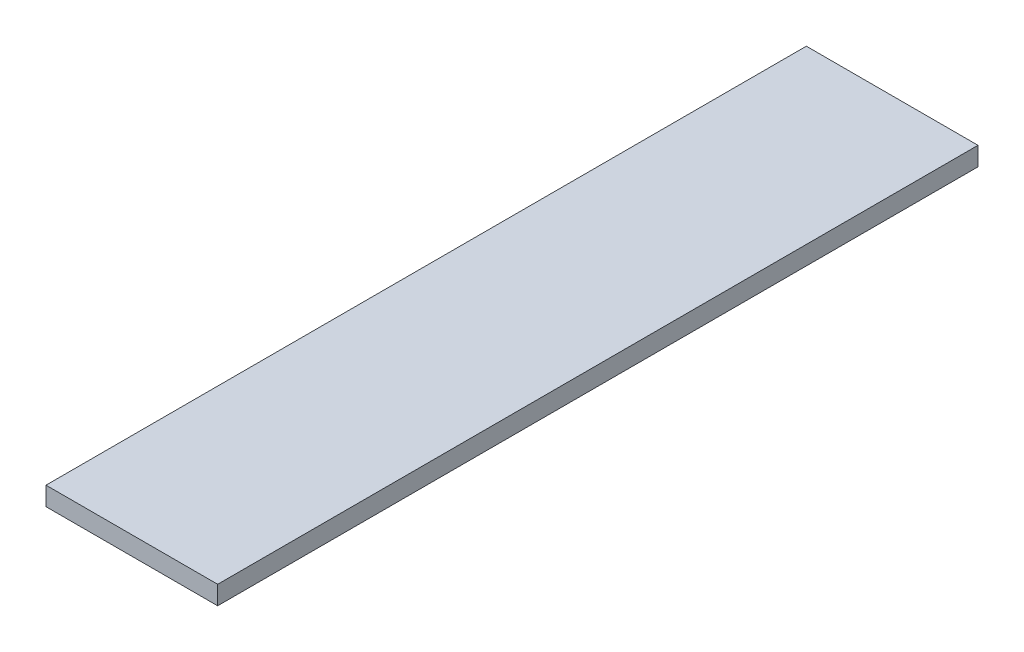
SolidWorks part; units mm, degrees
ref_plane "Front Plane" through (0, 0, 0) normal (0, 0, 1) x (1, 0, 0)
ref_plane "Top Plane" through (0, 0, 0) normal (0, 1, 0) x (1, 0, 0)
ref_plane "Right Plane" through (0, 0, 0) normal (1, 0, 0) x (0, 0, -1)
sketch "Sketch1" plane through (0, 0, 0) normal (0, 1, 0) x (1, 0, 0)
  line L1 (-584.2, 2587.625) -> (584.2, 2587.625)
  line L2 (-584.2, 2587.625) -> (-584.2, -2587.625)
  line L3 (-584.2, -2587.625) -> (584.2, -2587.625)
  line L4 (584.2, 2587.625) -> (584.2, -2587.625)
  line L5 (-584.2, 2587.625) -> (584.2, -2587.625) construction
  line L6 (-584.2, -2587.625) -> (584.2, 2587.625) construction
  point P0 (0, 0)
  dimension "D1" = 1168.4
  dimension "D2" = 5175.25
extrude "Boss-Extrude1" add sketch "Sketch1" along normal blind 127
